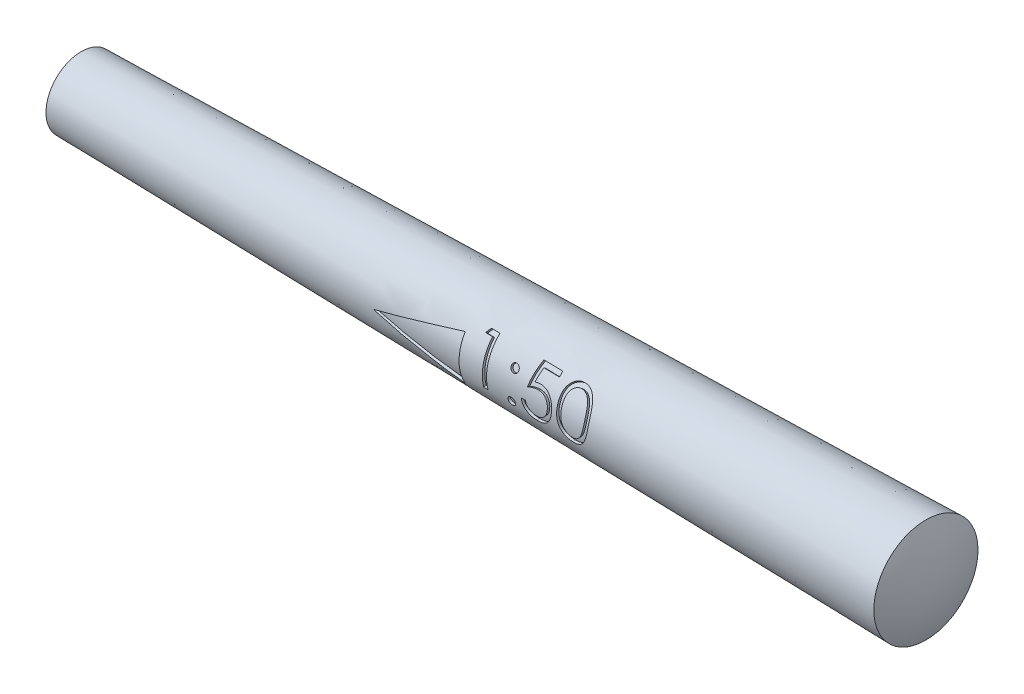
SolidWorks part; units mm, degrees
ref_plane "Front Plane" through (0, 0, 0) normal (0, 0, 1) x (1, 0, 0)
ref_plane "Top Plane" through (0, 0, 0) normal (0, 1, 0) x (1, 0, 0)
ref_plane "Right Plane" through (0, 0, 0) normal (1, 0, 0) x (0, 0, -1)
sketch "Sketch1" plane through (0, 0, 0) normal (1, 0, 0) x (0, 0, -1)
  circle A0 centre (0, 0) radius 0.75
  dimension "D1" = 1.5
extrude "Extrude1" add sketch "Sketch1" along normal mid plane 18
draft "Draft1" type of draft neutral plane draft angle 1.146 faces to draft 1 parameters "D1"=1.146
sketch "Sketch2" plane through (0, 0, 0) normal (0, 0, 1) x (1, 0, 0)
  line L0 (-9, 0) -> (-9, 0.75)
  line L1 (-9, 0.75) -> (-9, -0.75) construction
  line L2 (-9, 0) -> (-9.23, 0)
  line L3 (-9.23, 0) -> (-9.23, -0.93) construction
  line L4 (9, 0) -> (9, 1.11)
  line L5 (9, -1.11) -> (9, 1.11) construction
  line L6 (9, 0) -> (9.23, 0)
  line L7 (9.23, 0) -> (9.23, -0.93) construction
  line L8 (-9, -0.75) -> (9, -1.11) construction
  arc A0 (-9.23, 0) -> (-9, 0.75) centre (-7.8922, 0) cw
  arc A1 (9.23, 0) -> (9, 1.11) centre (6.4365, 0) ccw
  point P14 (0, -0.93)
revolve "Revolve1" add sketch "Sketch2" angle 360 about L2
sketch "Sketch5" plane through (0, 0, 0) normal (0, 0, 1) x (1, 0, 0)
  line L0 (0, 0.93) -> (0, -0.93) construction
  line L1 (9, 1.11) -> (-9, 0.75) construction
  line L2 (-9, -0.75) -> (9, -1.11) construction
ref_plane "Plane2" through (0, 0, 0) normal (-0.02, 0, 0.9998) x (0.9998, 0, 0.02)
sketch "Sketch6" plane through (0, 0, 0) normal (-0.02, 0, 0.9998) x (0.9998, 0, 0.02)
  line L0 (0, 0) -> (0, 0.5)
  line L1 (0, 0.93) -> (0, -0.93) construction
  line L2 (0, 0.5) -> (-1.866, 0)
  line L3 (-1.866, 0) -> (0, -0.5)
  line L4 (0, -0.5) -> (0, 0)
  line L5 (0, -0.25) -> (3, -0.25) construction
  text T0 "1:50" font "Century Gothic" height 1
  dimension "D1" = 1
  dimension "D2" = 30
  dimension "D3" = 3
wrap "Wrap2" sketch "Sketch6" wrap type deboss source sketch "Sketch6" thickness 0.05 parameters "D1"=0.05
equation "\"D2@Sketch2\" = \"D1@Sketch2\""
